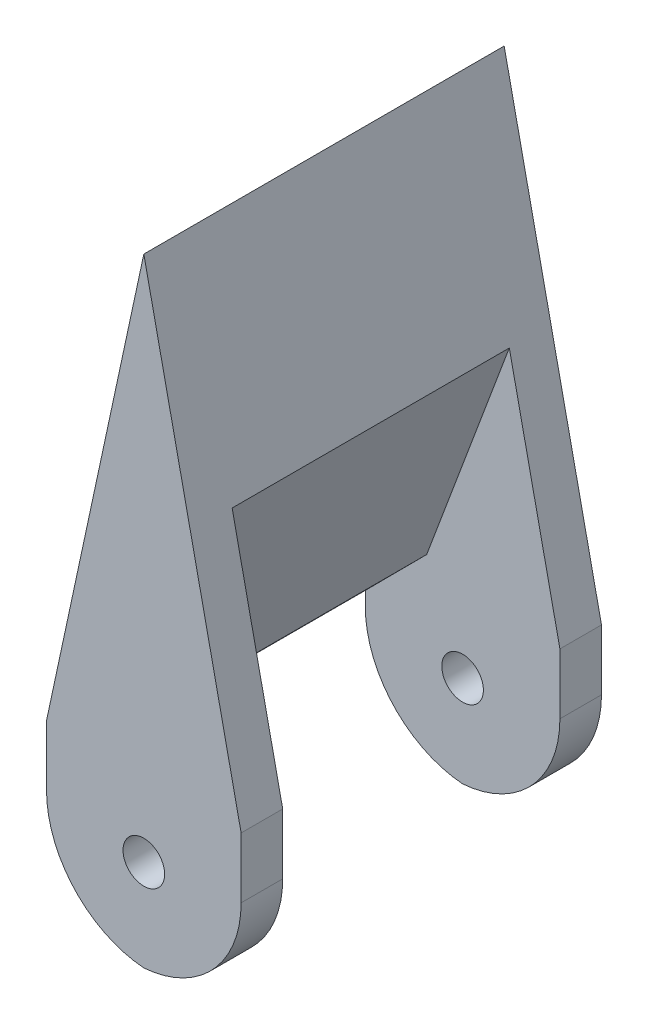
SolidWorks part; units mm, degrees
ref_plane "Front Plane" through (0, 0, 0) normal (0, 0, 1) x (1, 0, 0)
ref_plane "Top Plane" through (0, 0, 0) normal (0, 1, 0) x (1, 0, 0)
ref_plane "Right Plane" through (0, 0, 0) normal (1, 0, 0) x (0, 0, -1)
sketch "Sketch1" plane through (0, 0, 0) normal (0, 0, 1) x (1, 0, 0)
  line L0 (-23.2046, -1.6441) -> (-19.6942, 14.6864)
  line L4 (-23.2046, -7.6281) -> (-23.2046, -1.6441)
  line L5 (-19.6942, 22.5936) -> (-19.6942, -13.6516) construction
  line L6 (-23.2046, -7.6281) -> (-16.1838, -7.6281)
  line L7 (-16.1838, -7.6281) -> (-16.1838, -1.6441)
  line L8 (-16.1838, -1.6441) -> (-19.6942, 14.6864)
  circle A0 centre (-19.6942, -4.3136) radius 0.75
  point P9 (-19.6942, -7.6281)
  dimension "D2" = 1.5
  dimension "D1" = 19
  dimension "D3" = 7.0207
extrude "Boss-Extrude1" add sketch "Sketch1" along normal mid plane 13
fillet "Fillet1" radius 3.8 2 edges at (-16.1838, -7.6281, 0) (-23.2046, -7.6281, 0)
sketch "Sketch6" plane through (-15.8069, -3.3978, 0) normal (0.9777, 0.2102, 0) x (0, 0, -1)
  line L0 (-6.5, 1.7937) -> (-6.5, 18.4973) construction
  line L3 (-5, 10.8212) -> (-5, 1.7937) construction
  line L4 (-6.5, 1.7937) -> (6.5, 1.7937) construction
  line L5 (0, 55) -> (0, -55) construction
  line L6 (5, 10.8212) -> (5, 1.7937) construction
  dimension "D2" = 1.5
ref_plane "Plane1" through (0, 0, 5) normal (0, 0, 1) x (1, 0, 0)
sketch "Sketch7" plane through (0, 0, 5) normal (0, 0, 1) x (1, 0, 0)
  line L0 (-20.9874, -1.0967) -> (-15.7558, 12.8498)
  line L1 (-15.7558, 12.8498) -> (-14.1915, -11.367)
  line L3 (-24.8215, -4.9548) -> (-20.9874, -1.0967)
  line L4 (-24.8215, -4.9548) -> (-27.9932, -9.9245)
  line L5 (-27.9932, -9.9245) -> (-14.1915, -11.367)
  line L6 (-13.5261, 12.1292) -> (-24.9663, -18.368) construction
  point P6 (-10.722, 10.809)
  point P7 (-27.9932, -16.8214)
  dimension "D1" = 2.3407
extrude "Cut-Extrude3" cut sketch "Sketch7" against normal offset from surface (10 mm away) 1.5
